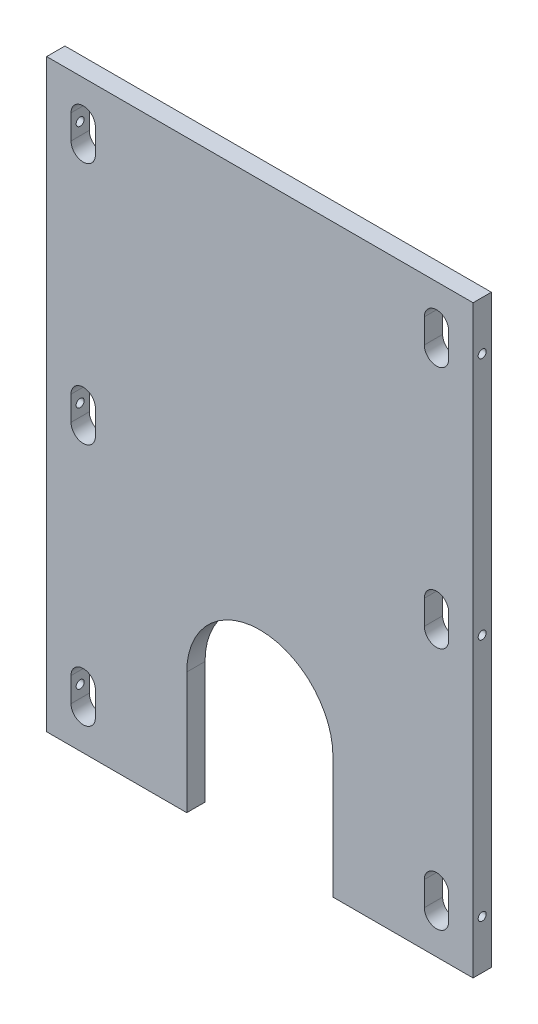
SolidWorks part; units mm, degrees
ref_plane "Front Plane" through (0, 0, 0) normal (0, 0, 1) x (1, 0, 0)
ref_plane "Top Plane" through (0, 0, 0) normal (0, 1, 0) x (1, 0, 0)
ref_plane "Right Plane" through (0, 0, 0) normal (1, 0, 0) x (0, 0, -1)
sketch "Sketch1" plane through (0, 0, 0) normal (0, 0, 1) x (1, 0, 0)
  line L1 (-222.25, -304.8) -> (222.25, -304.8)
  line L2 (-222.25, -304.8) -> (-222.25, 304.8)
  line L3 (-222.25, 304.8) -> (222.25, 304.8)
  line L4 (222.25, -304.8) -> (222.25, 304.8)
  dimension "D1" = 444.5
  dimension "D2" = 609.6
  dimension "D3" = 222.25
  dimension "D4" = 304.8
extrude "Extrude1" add sketch "Sketch1" along normal mid plane 19.05
sketch "Sketch3" plane through (0, 0, 9.525) normal (0, 0, 1) x (1, 0, 0)
  line L0 (-171.45, 266.7) -> (-171.45, 241.3)
  line L1 (-196.85, 241.3) -> (-196.85, 266.7)
  arc A0 (-171.45, 266.7) -> (-196.85, 266.7) centre (-184.15, 266.7) ccw
  arc A1 (-196.85, 241.3) -> (-171.45, 241.3) centre (-184.15, 241.3) ccw
  dimension "D1" = 25.4
  dimension "D2" = 241.3
  dimension "D3" = 266.7
  dimension "D4" = 184.15
extrude "Cut-Extrude2" cut sketch "Sketch3" against normal through all
sketch "Sketch4" plane through (-222.25, 0, 0) normal (-1, 0, 0) x (0, 0, 1)
  line L1 (-9.525, 241.3) -> (9.525, 241.3) construction
  line L3 (9.525, 304.8) -> (9.525, -304.8) construction
  circle A0 centre (0, 254) radius 4.191
  dimension "D1" = 8.382
  dimension "D2" = 12.7
  dimension "D3" = 9.525
pattern_linear "LPattern2" count 3 spacing 254 along (0, -1, 0) of "Cut-Extrude2"
mirror "Mirror1" about plane through (0, 0, 0) normal (1, 0, 0) of "LPattern2", "Cut-Extrude2"
extrude "Cut-Extrude3" cut sketch "Sketch4" against normal up to next
mirror "Mirror2" about plane through (0, 0, 0) normal (1, 0, 0) of "Cut-Extrude3"
pattern_linear "LPattern3" count 3 spacing 254 along (0, -1, 0) of "Mirror2", "Cut-Extrude3"
sketch "Sketch5" plane through (0, 0, 9.525) normal (0, 0, 1) x (1, 0, 0)
  line L0 (76.2, -177.8) -> (76.2, -304.8)
  line L1 (-222.25, -304.8) -> (222.25, -304.8) construction
  line L2 (-76.2, -177.8) -> (-76.2, -304.8)
  line L3 (-76.2, -304.8) -> (76.2, -304.8)
  arc A0 (76.2, -177.8) -> (-76.2, -177.8) centre (0, -177.8) ccw
  dimension "D1" = 152.4
  dimension "D2" = 177.8
extrude "Cut-Extrude4" cut sketch "Sketch5" against normal through all
